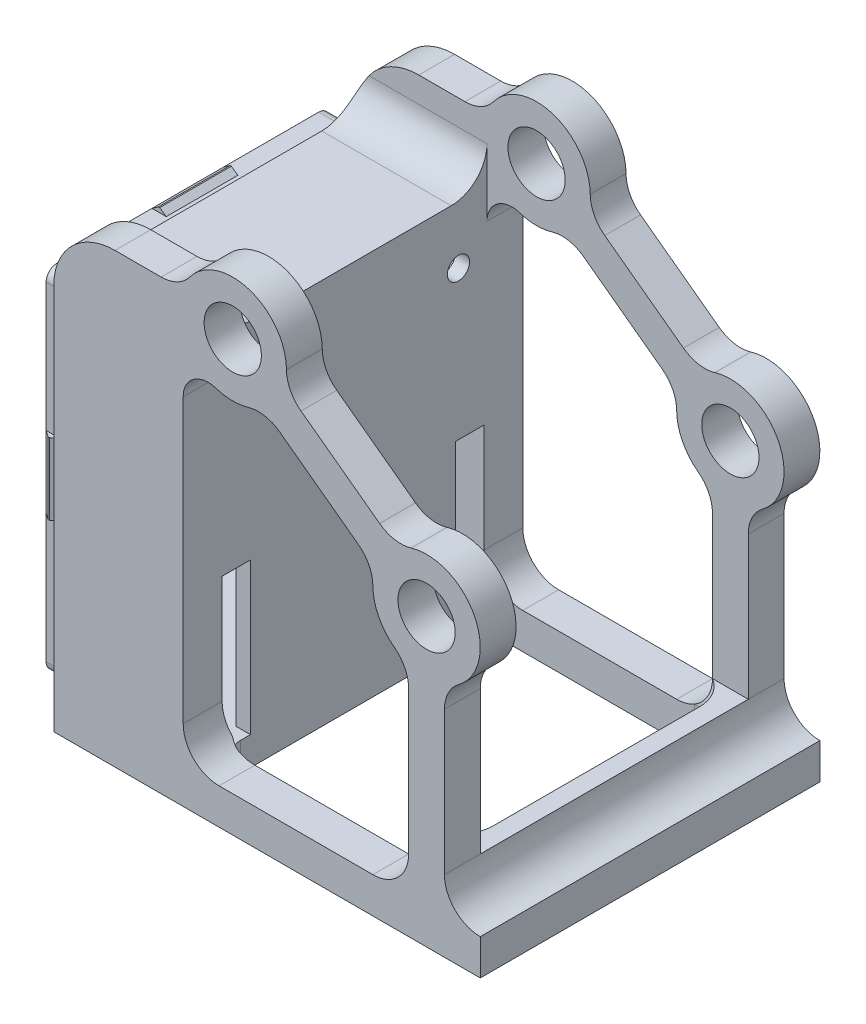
SolidWorks part; units mm, degrees
ref_plane "Alzado" through (0, 0, 0) normal (0, 0, 1) x (1, 0, 0)
ref_plane "Planta" through (0, 0, 0) normal (0, 1, 0) x (1, 0, 0)
ref_plane "Vista lateral" through (0, 0, 0) normal (1, 0, 0) x (0, 0, -1)
sketch "Croquis1" plane through (0, 0, 0) normal (0, 0, 1) x (1, 0, 0)
  line L0 (-92.1577, 342.1001) -> (-65.0867, 322.1001) construction
  line L1 (-82.6291, 338.1686) -> (-71.6442, 330.053)
  line L2 (-85.6002, 334.1471) -> (-74.6153, 326.0315)
  line L3 (-65.0867, 322.1001) -> (-65.0867, 282.1001) construction
  line L4 (-62.5867, 312.1001) -> (-62.5867, 292.1001)
  line L5 (-57.5867, 287.1001) -> (-57.5867, 282.1001)
  line L6 (-57.5867, 282.1001) -> (-117.1577, 282.1001)
  line L7 (-117.1577, 282.1001) -> (-117.1577, 349.6001)
  line L8 (-117.1577, 349.6001) -> (-112.1577, 349.6001)
  line L9 (-92.1577, 342.1001) -> (-117.1577, 342.1001) construction
  line L10 (-102.1577, 344.6001) -> (-107.1577, 344.6001)
  line L11 (-102.1577, 339.6001) -> (-107.1577, 339.6001)
  line L12 (-112.1577, 334.6001) -> (-112.1577, 292.1001)
  line L13 (-67.5867, 312.1001) -> (-67.5867, 292.1001)
  line L14 (-107.1577, 287.1001) -> (-72.5867, 287.1001)
  arc A0 (-72.5865, 322.046) -> (-74.6153, 326.0315) centre (-77.5863, 322.0099) ccw
  arc A1 (-90.0059, 334.9154) -> (-85.6002, 334.1471) centre (-88.5713, 330.1256) cw
  circle A2 centre (-65.0867, 322.1001) radius 4
  circle A3 centre (-92.1577, 342.1001) radius 4
  arc A4 (-84.6579, 342.1541) -> (-98.1577, 346.6001) centre (-92.1577, 342.1001) ccw
  arc A5 (-72.5865, 322.046) -> (-69.5867, 316.1001) centre (-65.0867, 322.1001) ccw
  arc A6 (-84.6579, 342.1541) -> (-82.6291, 338.1686) centre (-79.6581, 342.1902) ccw
  arc A7 (-67.2385, 329.2847) -> (-71.6442, 330.053) centre (-68.6731, 334.0745) cw
  arc A8 (-60.5867, 316.1001) -> (-62.5867, 312.1001) centre (-57.5867, 312.1001) ccw
  arc A9 (-62.5867, 292.1001) -> (-57.5867, 287.1001) centre (-57.5867, 292.1001) ccw
  arc A10 (-98.1577, 346.6001) -> (-102.1577, 344.6001) centre (-102.1577, 349.6001) cw
  arc A11 (-112.1577, 349.6001) -> (-107.1577, 344.6001) centre (-107.1577, 349.6001) ccw
  arc A12 (-112.1577, 334.6001) -> (-107.1577, 339.6001) centre (-107.1577, 334.6001) cw
  arc A13 (-98.1577, 337.6001) -> (-102.1577, 339.6001) centre (-102.1577, 334.6001) ccw
  arc A14 (-112.1577, 292.1001) -> (-107.1577, 287.1001) centre (-107.1577, 292.1001) ccw
  arc A15 (-67.5867, 292.1001) -> (-72.5867, 287.1001) centre (-72.5867, 292.1001) cw
  arc A16 (-69.5867, 316.1001) -> (-67.5867, 312.1001) centre (-72.5867, 312.1001) cw
  arc A17 (-99.6577, 342.1001) -> (-98.1577, 337.6001) centre (-92.1577, 342.1001) ccw construction
  arc A18 (-98.1577, 337.6001) -> (-90.0059, 334.9154) centre (-92.1577, 342.1001) ccw
  arc A19 (-98.1577, 346.6001) -> (-99.6577, 342.1001) centre (-92.1577, 342.1001) ccw construction
  arc A20 (-69.5867, 316.1001) -> (-65.0867, 314.6001) centre (-65.0867, 322.1001) ccw construction
  arc A21 (-60.5867, 316.1001) -> (-67.2385, 329.2847) centre (-65.0867, 322.1001) ccw
  arc A22 (-65.0867, 314.6001) -> (-60.5867, 316.1001) centre (-65.0867, 322.1001) ccw construction
  dimension "D5" = 8
  dimension "D6" = 8
  dimension "D7" = 15
  dimension "D8" = 5
  dimension "D10" = 2.5
  dimension "D11" = 5
  dimension "D13" = 5
  dimension "D15" = 25
  dimension "D16" = 40
  dimension "D1" = 27.0711
  dimension "D2" = 20
  dimension "D3" = 322.1001
  dimension "D4" = 65.0867
  dimension "D9" = 5
  dimension "D12" = 5
  dimension "D14" = 2.5
extrude "Saliente-Extruir1" add sketch "Croquis1" along normal blind 5 contours A11 L10 A10 A4 A6 L1 A7 A21 A8 L4 A9 L5 L6 L7 L8
ref_plane "Plano1" through (0, 0, -18.7157) normal (0, 0, -1) x (-1, 0, 0)
ref_plane "Plano3" through (-122.1577, 0, 0) normal (-1, 0, 0) x (0, 0, 1)
mirror "Simetría2" about plane through (0, 0, -18.7157) normal (0, 0, -1)
sketch "Croquis2" plane through (-122.1577, 0, 0) normal (-1, 0, 0) x (0, 0, 1)
  line L59 (-13.9386, 286.1001) -> (-5.7128, 286.1001)
  line L66 (-36.9957, 286.1001) -> (-13.9386, 286.1001)
  line L67 (-36.9957, 332.05) -> (-36.9957, 286.1001)
  line L68 (-0.4357, 332.05) -> (-36.9957, 332.05)
  line L69 (-0.4357, 286.1001) -> (-0.4357, 332.05)
  line L70 (-5.7128, 286.1001) -> (-0.4357, 286.1001)
  line L88 (-38.0052, 284.983) -> (-37.6518, 284.7466)
  line L89 (-37.6518, 284.7466) -> (-37.3436, 284.6392)
  line L90 (-37.3436, 284.6392) -> (-37.0896, 284.6013)
  line L91 (-37.0896, 284.6013) -> (-23.7157, 284.6001)
  line L92 (-23.7157, 284.6001) -> (-13.7157, 284.6001)
  line L93 (-13.7157, 284.6001) -> (-0.298, 284.6033)
  line L94 (-0.298, 284.6033) -> (0.089, 284.6888)
  line L95 (0.089, 284.6888) -> (0.4344, 284.8747)
  line L96 (0.4344, 284.8747) -> (0.6556, 285.0683)
  line L97 (0.6556, 285.0683) -> (0.8735, 285.3562)
  line L98 (0.8735, 285.3562) -> (1.0185, 285.7206)
  line L99 (1.0185, 285.7206) -> (1.0628, 286.0032)
  line L100 (1.0628, 286.0032) -> (1.0643, 297.895)
  line L101 (1.0643, 297.895) -> (1.0643, 304.0751)
  line L102 (1.0643, 304.0751) -> (1.0643, 314.0751)
  line L103 (1.0643, 314.0751) -> (1.0612, 332.2296)
  line L104 (1.0612, 332.2296) -> (0.949, 332.6342)
  line L105 (0.949, 332.6342) -> (0.8078, 332.892)
  line L106 (0.8078, 332.892) -> (0.62, 333.1196)
  line L107 (0.62, 333.1196) -> (0.3082, 333.3591)
  line L108 (0.3082, 333.3591) -> (-0.0562, 333.5042)
  line L109 (-0.0562, 333.5042) -> (-0.3417, 333.5488)
  line L110 (-0.3417, 333.5488) -> (-13.7157, 333.5501)
  line L111 (-13.7157, 333.5501) -> (-23.7157, 333.5501)
  line L112 (-23.7157, 333.5501) -> (-37.1122, 333.5471)
  line L113 (-37.1122, 333.5471) -> (-37.3617, 333.5065)
  line L114 (-37.3617, 333.5065) -> (-37.6397, 333.4079)
  line L115 (-37.6397, 333.4079) -> (-37.945, 333.2167)
  line L116 (-37.945, 333.2167) -> (-38.1939, 332.9571)
  line L117 (-38.1939, 332.9571) -> (-38.3466, 332.7059)
  line L118 (-38.3466, 332.7059) -> (-38.4498, 332.4295)
  line L119 (-38.4498, 332.4295) -> (-38.4955, 332.1318)
  line L120 (-38.4955, 332.1318) -> (-38.4957, 314.0751)
  line L121 (-38.4957, 314.0751) -> (-38.4957, 304.0751)
  line L122 (-38.4957, 304.0751) -> (-38.4902, 285.9087)
  line L123 (-38.4902, 285.9087) -> (-38.3803, 285.5159)
  line L124 (-38.3803, 285.5159) -> (-38.2392, 285.2581)
  line L125 (-38.2392, 285.2581) -> (-38.0052, 284.983)
extrude "Saliente-Extruir2" add sketch "Croquis2" against normal blind 21.08
sketch "Croquis3" plane through (-117.1577, 0, 0) normal (-1, 0, 0) x (0, 0, 1)
  line L0 (-42.4313, 349.6001) -> (-42.4313, 282.1001) construction
  line L2 (-42.4313, 336.05) -> (-42.4313, 282.1001)
  line L3 (-42.4313, 282.1001) -> (5, 282.1001)
  line L4 (5, 336.05) -> (5, 282.1001)
  line L5 (-0.4357, 332.05) -> (-36.9957, 332.05) construction
  line L6 (-36.9957, 332.05) -> (-0.4357, 332.05)
  line L7 (-36.9957, 332.05) -> (-36.9957, 286.1001)
  line L8 (-36.9957, 286.1001) -> (-0.4357, 286.1001)
  line L9 (-0.4357, 332.05) -> (-0.4357, 286.1001)
  line L10 (-36.9957, 332.05) -> (-36.9957, 286.1001) construction
  line L11 (-36.9957, 286.1001) -> (-0.4357, 286.1001) construction
  line L12 (-0.4357, 286.1001) -> (-0.4357, 332.05) construction
  line L14 (5, 349.6001) -> (5, 282.1001) construction
  line L15 (-42.4313, 282.1001) -> (-37.4313, 282.1001) construction
  line L16 (-42.4313, 336.05) -> (5, 336.05)
  line L17 (-36.9957, 286.1001) -> (-36.9957, 282.1001) construction
  line L18 (-36.9957, 332.05) -> (-36.9957, 336.05) construction
extrude "Saliente-Extruir3" add sketch "Croquis3" against normal up to surface (16.08 mm away)
ref_plane "Plano2" through (-106.0777, 0, 0) normal (1, 0, 0) x (0, 0, -1)
sketch "Croquis4" plane through (-106.0777, 0, 0) normal (1, 0, 0) x (0, 0, -1)
  line L9 (33.0497, 307.2351) -> (36.9957, 307.2351)
  line L10 (36.9957, 307.2351) -> (36.9957, 286.1001)
  line L11 (36.9957, 286.1001) -> (33.0497, 286.1001)
  line L12 (33.0497, 286.1001) -> (33.0497, 307.2351)
  line L13 (4.3816, 299.6151) -> (4.3816, 286.1001)
  line L14 (4.3816, 286.1001) -> (0.4357, 286.1001)
  line L15 (0.4357, 286.1001) -> (0.4357, 307.2351)
  line L16 (0.4357, 307.2351) -> (4.3816, 307.2351)
  line L17 (4.3816, 307.2351) -> (4.3816, 299.6151)
  line L82 (35.5897, 306.5591) -> (35.5897, 305.371)
  line L83 (34.4016, 306.5591) -> (35.5897, 306.5591)
  line L84 (34.4016, 305.371) -> (34.4016, 306.5591)
  line L85 (35.5897, 305.371) -> (34.4016, 305.371)
  line L86 (35.5897, 304.0191) -> (35.5897, 302.831)
  line L87 (34.4016, 304.0191) -> (35.5897, 304.0191)
  line L88 (34.4016, 302.831) -> (34.4016, 304.0191)
  line L89 (35.5897, 302.831) -> (34.4016, 302.831)
  line L90 (35.5897, 301.4791) -> (35.5897, 300.291)
  line L91 (35.5897, 300.291) -> (34.4016, 300.291)
  line L92 (34.4016, 300.291) -> (34.4016, 301.4791)
  line L93 (34.4016, 301.4791) -> (35.5897, 301.4791)
  line L94 (35.5897, 298.9391) -> (35.5897, 297.751)
  line L95 (34.4016, 298.9391) -> (35.5897, 298.9391)
  line L96 (34.4016, 297.751) -> (34.4016, 298.9391)
  line L97 (35.5897, 297.751) -> (34.4016, 297.751)
  line L98 (35.5897, 296.3991) -> (35.5897, 295.211)
  line L99 (35.5897, 295.211) -> (34.4016, 295.211)
  line L100 (34.4016, 295.211) -> (34.4016, 296.3991)
  line L101 (34.4016, 296.3991) -> (35.5897, 296.3991)
  line L102 (35.5897, 292.671) -> (34.4016, 292.671)
  line L103 (35.5897, 293.8591) -> (35.5897, 292.671)
  line L104 (34.4016, 293.8591) -> (35.5897, 293.8591)
  line L105 (34.4016, 292.671) -> (34.4016, 293.8591)
  line L106 (35.5897, 290.131) -> (34.4016, 290.131)
  line L107 (35.5897, 291.3191) -> (35.5897, 290.131)
  line L108 (34.4016, 291.3191) -> (35.5897, 291.3191)
  line L109 (34.4016, 290.131) -> (34.4016, 291.3191)
  line L110 (35.5897, 287.591) -> (34.4016, 287.591)
  line L111 (35.5897, 288.7791) -> (35.5897, 287.591)
  line L112 (34.4016, 287.591) -> (34.4016, 288.7791)
  line L113 (34.4016, 288.7791) -> (35.5897, 288.7791)
  line L114 (1.8416, 287.591) -> (3.0297, 287.591)
  line L115 (1.8416, 288.7791) -> (1.8416, 287.591)
  line L116 (3.0297, 288.7791) -> (1.8416, 288.7791)
  line L117 (3.0297, 287.591) -> (3.0297, 288.7791)
  line L118 (3.0297, 291.3191) -> (3.0297, 290.131)
  line L119 (3.0297, 290.131) -> (1.8416, 290.131)
  line L120 (1.8416, 290.131) -> (1.8416, 291.3191)
  line L121 (1.8416, 291.3191) -> (3.0297, 291.3191)
  line L122 (3.0297, 292.671) -> (3.0297, 293.8591)
  line L123 (1.8416, 292.671) -> (3.0297, 292.671)
  line L124 (1.8416, 293.8591) -> (1.8416, 292.671)
  line L125 (3.0297, 293.8591) -> (1.8416, 293.8591)
  line L126 (3.0297, 295.211) -> (1.8416, 295.211)
  line L127 (1.8416, 295.211) -> (1.8416, 296.3991)
  line L128 (1.8416, 296.3991) -> (3.0297, 296.3991)
  line L129 (3.0297, 296.3991) -> (3.0297, 295.211)
  line L130 (1.8416, 297.751) -> (3.0297, 297.751)
  line L131 (1.8416, 298.9391) -> (1.8416, 297.751)
  line L132 (3.0297, 297.751) -> (3.0297, 298.9391)
  line L133 (3.0297, 298.9391) -> (1.8416, 298.9391)
  line L134 (1.8416, 300.291) -> (3.0297, 300.291)
  line L135 (1.8416, 300.291) -> (1.8416, 301.4791)
  line L136 (1.8416, 301.4791) -> (3.0297, 301.4791)
  line L137 (3.0297, 301.4791) -> (3.0297, 300.291)
  line L138 (1.8416, 302.831) -> (3.0297, 302.831)
  line L139 (1.8416, 304.0191) -> (1.8416, 302.831)
  line L140 (3.0297, 302.831) -> (3.0297, 304.0191)
  line L141 (3.0297, 304.0191) -> (1.8416, 304.0191)
  line L142 (3.0297, 305.371) -> (1.8416, 305.371)
  line L143 (1.8416, 305.371) -> (1.8416, 306.5591)
  line L144 (1.8416, 306.5591) -> (3.0297, 306.5591)
  line L145 (3.0297, 306.5591) -> (3.0297, 305.371)
extrude "Saliente-Extruir4" add sketch "Croquis4" against normal blind 5
sketch "Croquis7" plane through (0, 0, -37.4313) normal (0, 0, 1) x (1, 0, 0)
  line L0 (-112.1577, 349.6001) -> (-117.1577, 349.6001) construction
  line L1 (-57.5867, 282.1001) -> (-57.5867, 287.1001) construction
  line L2 (-112.1577, 349.6001) -> (-117.1577, 349.6001)
  line L3 (-57.5867, 282.1001) -> (-57.5867, 287.1001)
  line L4 (-107.1577, 344.6001) -> (-107.1577, 342.1001)
  line L5 (-107.1577, 342.1001) -> (-117.1577, 342.1001)
  line L6 (-117.1577, 349.6001) -> (-117.1577, 282.1001) construction
  line L7 (-117.1577, 342.1001) -> (-117.1577, 349.6001)
  line L8 (-62.5867, 292.1001) -> (-65.0867, 292.1001)
  line L9 (-65.0867, 292.1001) -> (-65.0867, 282.1001)
  line L10 (-117.1577, 282.1001) -> (-57.5867, 282.1001) construction
  line L11 (-65.0867, 282.1001) -> (-57.5867, 282.1001)
  line L12 (-62.5867, 292.1001) -> (-62.5867, 312.1001) construction
  line L13 (-102.1577, 344.6001) -> (-107.1577, 344.6001) construction
  arc A0 (-112.1577, 349.6001) -> (-107.1577, 344.6001) centre (-107.1577, 349.6001) ccw construction
  arc A1 (-62.5867, 292.1001) -> (-57.5867, 287.1001) centre (-57.5867, 292.1001) ccw construction
  arc A2 (-112.1577, 349.6001) -> (-107.1577, 344.6001) centre (-107.1577, 349.6001) ccw
  arc A3 (-62.5867, 292.1001) -> (-57.5867, 287.1001) centre (-57.5867, 292.1001) ccw
  dimension "D1" = 2.5
  dimension "D2" = 2.5
extrude "Saliente-Extruir7" add sketch "Croquis7" along normal up to surface (37.4313 mm away)
fillet "Redondeo3" radius 5 4 edges at (-107.1577, 343.3501, -37.4313) (-107.1577, 343.3501, 0) (-65.0867, 287.1001, 0) (-65.0867, 287.1001, -37.4313)
sketch "Croquis8" plane through (-122.1577, 0, 0) normal (-1, 0, 0) x (0, 0, 1)
  line L0 (-36.9957, 286.1001) -> (-0.4357, 286.1001) construction
  line L1 (-0.4357, 286.1001) -> (-0.4357, 332.05) construction
  line L2 (-36.9957, 332.05) -> (-36.9957, 286.1001) construction
  line L3 (-0.4357, 332.05) -> (-36.9957, 332.05) construction
  line L4 (-36.9957, 286.1001) -> (-0.4357, 286.1001)
  line L5 (-0.4357, 286.1001) -> (-0.4357, 332.05)
  line L6 (-36.9957, 332.05) -> (-36.9957, 286.1001)
  line L7 (-0.4357, 332.05) -> (-36.9957, 332.05)
  line L10 (2.5643, 335.05) -> (-39.9957, 335.05)
  line L11 (-39.9957, 335.05) -> (-39.9957, 283.1001)
  line L12 (-39.9957, 283.1001) -> (2.5643, 283.1001)
  line L13 (2.5643, 283.1001) -> (2.5643, 335.05)
  dimension "D1" = 3
extrude "Saliente-Extruir8" add sketch "Croquis8" against normal up to surface (5 mm away) contours L12 L13 L10 L11 M13 M49 M48 M47 M46 M45 M44 M43 M42 M41 M40 M39 M38 M37 M36 M35 M34 M33 M32 M31 M30 M29 M28 M27 M26 M25 M24 M23 M22 M21 M20 M19 M18 M17 M16 M15 M14 | M49 M13 M14 M15 M16 M17 M18 M19 M20 M21 M22 M23 M24 M25 M26 M27 M28 M29 M30 M31 M32 M33 M34 M35 M36 M37 M38 M39 M40 M41 M42 M43 M44 M45 M46 M47 M48 M12 M9 M10 M11
sketch "Croquis9" plane through (-122.1577, 0, 0) normal (-1, 0, 0) x (0, 0, 1)
  line L10 (-18.7157, 333.55) -> (-18.7157, -49666.45) construction
  line L11 (1.0643, 309.075) -> (-49998.9357, 309.075) construction
  line L12 (-36.9957, 333.55) -> (-0.4357, 333.55)
  line L13 (1.0643, 332.05) -> (1.0643, 286.1001)
  line L14 (-38.4957, 284.6001) -> (1.0643, 284.6001)
  line L15 (1.0643, 284.6001) -> (1.0643, 333.55)
  line L16 (-38.4957, 333.55) -> (-38.4957, 284.6001)
  line L17 (1.0643, 333.55) -> (-38.4957, 333.55)
  line L18 (-38.4957, 284.6001) -> (1.0643, 284.6001) construction
  line L19 (1.0643, 284.6001) -> (1.0643, 333.55) construction
  line L20 (-38.4957, 333.55) -> (-38.4957, 284.6001) construction
  line L21 (1.0643, 333.55) -> (-38.4957, 333.55) construction
  line L22 (-0.4357, 284.6001) -> (-36.9957, 284.6001)
  line L23 (-38.4957, 286.1001) -> (-38.4957, 332.05)
  arc A0 (-36.9957, 333.55) -> (-38.4957, 332.05) centre (-36.9957, 332.05) ccw
  arc A1 (-0.4357, 333.55) -> (1.0643, 332.05) centre (-0.4357, 332.05) cw
  arc A2 (-0.4357, 284.6001) -> (1.0643, 286.1001) centre (-0.4357, 286.1001) ccw
  arc A3 (-36.9957, 284.6001) -> (-38.4957, 286.1001) centre (-36.9957, 286.1001) cw
  point P5 (-18.7157, 333.55)
  point P8 (1.0643, 309.075)
  dimension "D2" = 1.5
  dimension "D1" = 1.5
extrude "Cortar-Extruir1" cut sketch "Croquis9" against normal up to surface (5 mm away) flip side to cut
sketch "Croquis12" plane through (-101.0777, 0, 0) normal (1, 0, 0) x (0, 0, -1)
  line L0 (0.4357, 332.05) -> (36.9957, 332.05) construction
  line L1 (0.4357, 286.1001) -> (0.4357, 332.05) construction
  line L2 (8.2357, 328) -> (8.2357, 332.05)
  line L3 (8.2357, 332.05) -> (0.4357, 332.05)
  line L4 (0.4357, 332.05) -> (0.4357, 323.75)
  line L5 (0.4357, 323.75) -> (3.9857, 323.75)
  line L6 (18.7157, 333.55) -> (18.7157, 50333.55) construction
  line L7 (0.4357, 333.55) -> (36.9957, 333.55) construction
  line L8 (36.9957, 323.75) -> (33.4457, 323.75)
  line L9 (36.9957, 332.05) -> (36.9957, 323.75)
  line L10 (29.1957, 332.05) -> (36.9957, 332.05)
  line L11 (29.1957, 328) -> (29.1957, 332.05)
  circle A0 centre (3.9857, 328) radius 1.55
  circle A1 centre (3.9857, 328) radius 2.875 construction
  arc A2 (3.9857, 323.75) -> (8.2357, 328) centre (3.9857, 328) ccw
  arc A3 (33.4457, 323.75) -> (29.1957, 328) centre (33.4457, 328) cw
  circle A4 centre (33.4457, 328) radius 1.55
  circle A5 centre (33.4457, 328) radius 2.875 construction
  point P16 (18.7157, 333.55)
  dimension "D1" = 3.1
  dimension "D2" = 5.75
  dimension "D5" = 4.25
  dimension "D3" = 4.05
  dimension "D4" = 3.55
extrude "Saliente-Extruir11" add sketch "Croquis12" against normal blind 11.6145 contours A3 L8 L11 A4 M14 M13 | L5 A2 L2 A0 M13 M16
sketch "Croquis14" plane through (-112.6923, 0, 0) normal (-1, 0, 0) x (0, 0, 1)
  line L0 (-3.9857, 329.55) -> (-3.9857, 332.05)
  line L1 (-0.4357, 332.05) -> (-36.9957, 332.05) construction
  line L2 (-3.9857, 332.05) -> (-8.2357, 332.05)
  line L3 (-8.2357, 328) -> (-8.2357, 332.05) construction
  line L4 (-8.2357, 332.05) -> (-8.2357, 328)
  line L5 (-3.9857, 323.75) -> (-3.9857, 326.45)
  line L6 (-18.7157, 336.05) -> (-18.7157, 50336.05) construction
  line L7 (0, 336.05) -> (-37.4313, 336.05) construction
  line L8 (-29.1957, 332.05) -> (-29.1957, 328)
  line L9 (-33.4457, 332.05) -> (-29.1957, 332.05)
  line L10 (-33.4457, 329.55) -> (-33.4457, 332.05)
  line L11 (-33.4457, 323.75) -> (-33.4457, 326.45)
  circle A0 centre (-3.9857, 328) radius 1.55 construction
  arc A1 (-8.2357, 328) -> (-3.9857, 323.75) centre (-3.9857, 328) ccw construction
  arc A2 (-8.2357, 328) -> (-3.9857, 323.75) centre (-3.9857, 328) ccw
  arc A3 (-3.9857, 329.55) -> (-3.9857, 326.45) centre (-3.9857, 328) cw
  arc A4 (-29.1957, 328) -> (-33.4457, 323.75) centre (-33.4457, 328) cw
  arc A5 (-33.4457, 329.55) -> (-33.4457, 326.45) centre (-33.4457, 328) ccw
  point P20 (-18.7157, 336.05)
extrude "Cortar-Extruir2" cut sketch "Croquis14" against normal offset from surface (9.6145 mm away) 2
sketch "Croquis15" plane through (-101.0777, 0, 0) normal (1, 0, 0) x (0, 0, -1)
  line L8 (8.2357, 332.05) -> (8.2357, 328)
  line L9 (29.1957, 332.05) -> (8.2357, 332.05)
  line L10 (29.1957, 328) -> (29.1957, 332.05)
  line L11 (36.9957, 323.75) -> (33.4457, 323.75)
  line L12 (36.9957, 286.1001) -> (36.9957, 323.75)
  line L13 (0.4357, 286.1001) -> (36.9957, 286.1001)
  line L14 (0.4357, 323.75) -> (0.4357, 286.1001)
  line L15 (3.9857, 323.75) -> (0.4357, 323.75)
  line L16 (8.2357, 332.05) -> (8.2357, 328)
  line L17 (29.1957, 332.05) -> (8.2357, 332.05)
  line L18 (29.1957, 328) -> (29.1957, 332.05)
  line L19 (36.9957, 323.75) -> (33.4457, 323.75)
  line L20 (36.9957, 286.1001) -> (36.9957, 323.75)
  line L21 (0.4357, 286.1001) -> (36.9957, 286.1001)
  line L22 (0.4357, 323.75) -> (0.4357, 286.1001)
  line L23 (3.9857, 323.75) -> (0.4357, 323.75)
  line L24 (42.4313, 336.05) -> (-5, 336.05)
  line L25 (-5, 336.05) -> (-5, 287.1001)
  line L26 (-5, 287.1001) -> (0, 287.1001)
  line L27 (0, 287.1001) -> (0, 282.1001)
  line L28 (0, 282.1001) -> (37.4313, 282.1001)
  line L29 (37.4313, 282.1001) -> (37.4313, 287.1001)
  line L30 (37.4313, 287.1001) -> (42.4313, 287.1001)
  line L31 (42.4313, 287.1001) -> (42.4313, 336.05)
  line L32 (42.4313, 336.05) -> (-5, 336.05)
  line L33 (-5, 336.05) -> (-5, 287.1001)
  line L34 (-5, 287.1001) -> (0, 287.1001)
  line L35 (0, 287.1001) -> (0, 282.1001)
  line L36 (0, 282.1001) -> (37.4313, 282.1001)
  line L37 (37.4313, 282.1001) -> (37.4313, 287.1001)
  line L38 (37.4313, 287.1001) -> (42.4313, 287.1001)
  line L39 (42.4313, 287.1001) -> (42.4313, 336.05)
  circle A1 centre (33.4457, 328) radius 1.55
  circle A2 centre (33.4457, 328) radius 1.55
  circle A3 centre (3.9857, 328) radius 1.55
  circle A4 centre (3.9857, 328) radius 1.55
  arc A6 (29.1957, 328) -> (33.4457, 323.75) centre (33.4457, 328) ccw
  arc A7 (3.9857, 323.75) -> (8.2357, 328) centre (3.9857, 328) ccw
  arc A8 (29.1957, 328) -> (33.4457, 323.75) centre (33.4457, 328) ccw
  arc A9 (3.9857, 323.75) -> (8.2357, 328) centre (3.9857, 328) ccw
  dimension "D1" = 0
  dimension "D2" = 0
  dimension "D3" = 0
  dimension "D4" = 0
extrude "Saliente-Extruir12" add sketch "Croquis15" along normal blind 2
sketch "Croquis16" plane through (0, 286.1001, 0) normal (0, 1, 0) x (1, 0, 0)
  line L0 (-111.0777, 4.3816) -> (-106.0777, 4.3816) construction
  line L1 (-111.0777, 33.0497) -> (-106.0777, 33.0497) construction
  line L2 (-111.0777, 4.3816) -> (-106.0777, 4.3816) construction
  line L3 (-111.0777, 33.0497) -> (-106.0777, 33.0497) construction
  line L4 (-99.0777, 0.4357) -> (-99.0777, 36.9957) construction
  line L5 (-99.0777, 33.0497) -> (-101.0777, 33.0497)
  line L6 (-99.0777, 33.0497) -> (-99.0777, 4.3816)
  line L7 (-99.0777, 4.3816) -> (-101.0777, 4.3816)
  line L8 (-101.0777, 33.0497) -> (-101.0777, 4.3816)
  dimension "D1" = 2
extrude "Saliente-Extruir13" add sketch "Croquis16" along normal up to next
sketch "Croquis17" plane through (-112.6923, 0, 0) normal (-1, 0, 0) x (0, 0, 1)
  circle A0 centre (-3.9857, 328) radius 2.875
  circle A1 centre (-33.4457, 328) radius 2.875
  dimension "D1" = 5.75
extrude "Cortar-Extruir3" cut sketch "Croquis17" against normal up to surface (11.6145 mm away)
sketch "Croquis18" plane through (0, 0, -0.4357) normal (0, 0, -1) x (-1, 0, 0)
  line L0 (111.0777, 307.2351) -> (106.0777, 307.2351) construction
  line L1 (111.0777, 307.2351) -> (106.0777, 307.2351) construction
  line L2 (101.0777, 286.1001) -> (99.0777, 286.1001) construction
  line L3 (101.0777, 286.1001) -> (99.0777, 286.1001) construction
  line L4 (112.6923, 323.75) -> (99.0777, 323.75) construction
  line L5 (112.6923, 323.75) -> (99.0777, 323.75) construction
  line L6 (101.0777, 323.75) -> (101.0777, 324.4573)
  line L8 (99.0777, 323.75) -> (99.0777, 307.2351)
  line L9 (99.0777, 307.2351) -> (101.0777, 307.2351)
  line L10 (101.0777, 323.75) -> (101.0777, 307.2351)
  line L11 (101.0777, 324.4573) -> (99.0777, 324.4573)
  line L12 (99.0777, 287.1001) -> (99.0777, 336.05) construction
  line L13 (99.0777, 324.4573) -> (99.0777, 323.75)
extrude "Saliente-Extruir14" add sketch "Croquis18" along normal up to surface (36.56 mm away)
sketch "Croquis19" plane through (0, 0, -18.7157) normal (0, 0, -1) x (-1, 0, 0)
  line L0 (122.1577, 333.55) -> (121.2437, 334.19)
  line L1 (117.1577, 333.55) -> (122.1577, 333.55) construction
  line L2 (122.1577, 332.05) -> (122.1577, 333.55) construction
  line L3 (121.2437, 334.19) -> (121.0717, 334.19)
  line L4 (121.0717, 334.19) -> (120.1577, 333.55)
  line L5 (120.1577, 333.55) -> (122.1577, 333.55)
  line L6 (122.1577, 332.05) -> (122.1577, 286.1001) construction
  line L7 (122.1577, 332.05) -> (122.1577, 286.1001) construction
  line L8 (122.1577, 309.075) -> (50122.1577, 309.075) construction
  line L9 (120.1577, 284.6001) -> (122.1577, 284.6001)
  line L10 (121.0717, 283.9601) -> (120.1577, 284.6001)
  line L11 (121.2437, 283.9601) -> (121.0717, 283.9601)
  line L12 (122.1577, 284.6001) -> (121.2437, 283.9601)
  point P14 (122.1577, 309.075)
  dimension "D1" = 0.64
  dimension "D2" = 2
  dimension "D3" = 145
  dimension "D4" = 145
extrude "Saliente-Extruir15" add sketch "Croquis19" along normal mid plane 10 contours L4 L5 L0 L3
ref_plane "Plano4" through (0, 309.075, 0) normal (0, -1, 0) x (-1, 0, 0)
sketch "Croquis20" plane through (0, 309.075, 0) normal (0, -1, 0) x (-1, 0, 0)
  line L0 (122.1577, 38.4957) -> (121.2437, 39.1357)
  line L1 (121.2437, 39.1357) -> (121.0717, 39.1357)
  line L2 (121.0717, 39.1357) -> (120.1577, 38.4957)
  line L3 (117.1577, 38.4957) -> (122.1577, 38.4957) construction
  line L4 (120.1577, 38.4957) -> (122.1577, 38.4957)
  line L5 (122.1577, 36.9957) -> (122.1577, 38.4957) construction
  line L6 (120.1577, 18.7157) -> (50120.1577, 18.7157) construction
  line L7 (120.1577, 23.7157) -> (120.1577, 13.7157) construction
  line L8 (120.1577, -1.0643) -> (122.1577, -1.0643)
  line L9 (122.1577, -1.0643) -> (121.2437, -1.7043)
  line L10 (121.2437, -1.7043) -> (121.0717, -1.7043)
  line L11 (121.0717, -1.7043) -> (120.1577, -1.0643)
  point P14 (120.1577, 18.7157)
  dimension "D1" = 2
  dimension "D2" = 145
  dimension "D3" = 145
  dimension "D4" = 0.64
extrude "Saliente-Extruir16" add sketch "Croquis20" along normal mid plane 10
sketch "Croquis21" plane through (0, 286.1001, 0) normal (0, 1, 0) x (1, 0, 0)
  line L0 (-122.1577, 36.9957) -> (-122.1577, 23.7157) construction
  line L1 (-119.7377, 32.8913) -> (-113.7877, 32.8913)
  line L2 (-119.7377, 32.8913) -> (-119.7377, 25.8913)
  line L3 (-119.7377, 25.8913) -> (-113.7877, 25.8913)
  line L4 (-113.7877, 32.8913) -> (-113.7877, 25.8913)
  line L5 (-109.7877, 32.8913) -> (-103.8377, 32.8913)
  line L6 (-109.7877, 32.8913) -> (-109.7877, 25.8913)
  line L7 (-109.7877, 25.8913) -> (-103.8377, 25.8913)
  line L8 (-103.8377, 32.8913) -> (-103.8377, 25.8913)
  line L9 (-99.0777, 37.4313) -> (-70.0867, 37.4313) construction
  line L10 (-122.1577, 13.7157) -> (-122.1577, 0.4357) construction
  line L11 (-114.0577, 14.23) -> (-117.3577, 14.23)
  line L12 (-114.0577, 14.23) -> (-114.0577, 6)
  line L13 (-114.0577, 6) -> (-117.3577, 6)
  line L14 (-117.3577, 14.23) -> (-117.3577, 6)
  line L15 (-117.1577, -5) -> (-57.5867, -5) construction
  dimension "D1" = 2.42
  dimension "D2" = 5.95
  dimension "D3" = 7
  dimension "D4" = 4.54
  dimension "D5" = 4
  dimension "D6" = 4.8
  dimension "D7" = 3.3
  dimension "D8" = 11
  dimension "D9" = 8.23
extrude "Cortar-Extruir4" cut sketch "Croquis21" against normal through all
sketch "Croquis22" plane through (0, 282.1001, 0) normal (0, -1, 0) x (1, 0, 0)
  line L0 (-117.1577, -36.9957) -> (-122.1577, -36.9957) construction
  line L1 (-117.1577, -36.9957) -> (-103.8377, -36.9957)
  line L2 (-117.1577, -36.9957) -> (-117.1577, -0.4357)
  line L3 (-117.1577, -0.4357) -> (-103.8377, -0.4357)
  line L4 (-103.8377, -36.9957) -> (-103.8377, -0.4357)
  line L5 (-117.1577, -32.8913) -> (-117.1577, -42.4313) construction
  line L6 (-117.1577, -0.4357) -> (-122.1577, -0.4357) construction
  line L8 (-103.8377, -25.8913) -> (-103.8377, -32.8913) construction
extrude "Cortar-Extruir5" cut sketch "Croquis22" against normal up to surface (2.5 mm away)
fillet "Redondeo4" radius 2.5 4 edges at (-110.4977, 284.6001, -0.4357) (-103.8377, 284.6001, -13.1635) (-103.8377, 284.6001, -34.9435) (-110.4977, 284.6001, -36.9957)
fillet "Redondeo5" radius 3 2 edges at (-99.0777, 284.6001, -37.4313) (-99.0777, 284.6001, 0)
fillet "Redondeo6" radius 5 2 edges at (-99.0777, 287.1001, -39.7135) (-99.0777, 287.1001, 2.2822)
sketch "Croquis23" plane through (0, 0, 5) normal (0, 0, 1) x (1, 0, 0)
  line L0 (-117.1577, 349.6001) -> (-117.1577, 282.1001) construction
  line L1 (-102.1577, 344.6001) -> (-107.1577, 344.6001) construction
  line L3 (-108.6077, 344.6001) -> (-107.1577, 344.6001)
  line L4 (-107.1577, 344.6001) -> (-107.1577, 349.6001)
  line L5 (-107.1577, 349.6001) -> (-117.1577, 349.6001)
  line L6 (-112.1577, 349.6001) -> (-117.1577, 349.6001) construction
  line L7 (-117.1577, 349.6001) -> (-117.1577, 336.05)
  line L8 (-99.0777, 336.05) -> (-111.9429, 336.05) construction
  arc A0 (-108.6077, 344.6001) -> (-117.1577, 336.05) centre (-108.6077, 336.05) ccw
  arc A3 (-112.1577, 349.6001) -> (-107.1577, 344.6001) centre (-107.1577, 349.6001) ccw construction
extrude "Cortar-Extruir6" cut sketch "Croquis23" against normal through all
sketch "Croquis24" plane through (0, 0, -37.4313) normal (0, 0, 1) x (1, 0, 0)
  line L0 (-102.1577, 344.6001) -> (-108.6077, 344.6001) construction
  line L1 (-102.1577, 344.6001) -> (-102.1577, 342.1001) construction
  line L2 (-114.6493, 342.1001) -> (-102.1577, 342.1001) construction
  line L3 (-102.1577, 344.6001) -> (-108.6077, 344.6001)
  line L4 (-102.1577, 344.6001) -> (-102.1577, 342.1001)
  line L5 (-114.6493, 342.1001) -> (-102.1577, 342.1001)
  arc A0 (-108.6077, 344.6001) -> (-117.1577, 336.05) centre (-108.6077, 336.05) ccw construction
  arc A1 (-108.6077, 344.6001) -> (-114.6493, 342.1001) centre (-108.6077, 336.05) ccw
  arc A2 (-114.6493, 342.1001) -> (-117.1577, 336.05) centre (-108.6077, 336.05) ccw construction
extrude "Cortar-Extruir7" cut sketch "Croquis24" along normal up to surface (37.4313 mm away)
sketch "Croquis25" plane through (0, 0, 5) normal (0, 0, 1) x (1, 0, 0)
  line L0 (-99.0777, 336.05) -> (-99.0777, 292.1001) construction
  line L1 (-99.0777, 336.05) -> (-111.9429, 336.05) construction
  line L2 (-102.1577, 339.6001) -> (-107.1577, 339.6001) construction
  line L3 (-99.0777, 336.05) -> (-99.0777, 331.6672)
  line L4 (-99.0777, 336.05) -> (-111.9429, 336.05)
  line L5 (-102.1577, 339.6001) -> (-107.1577, 339.6001)
  line L6 (-99.0777, 331.6672) -> (-99.0777, 292.1001) construction
  arc A0 (-94.5038, 334.9764) -> (-99.0777, 331.6672) centre (-95.5936, 331.6672) ccw
  arc A1 (-98.1577, 337.6001) -> (-90.0059, 334.9154) centre (-92.1577, 342.1001) ccw construction
  arc A2 (-107.1577, 339.6001) -> (-111.9429, 336.05) centre (-107.1577, 334.6001) ccw construction
  arc A3 (-98.1577, 337.6001) -> (-102.1577, 339.6001) centre (-102.1577, 334.6001) ccw construction
  arc A4 (-98.1577, 337.6001) -> (-94.5038, 334.9764) centre (-92.1577, 342.1001) ccw
  arc A5 (-107.1577, 339.6001) -> (-111.9429, 336.05) centre (-107.1577, 334.6001) ccw
  arc A6 (-98.1577, 337.6001) -> (-102.1577, 339.6001) centre (-102.1577, 334.6001) ccw
  arc A7 (-94.5038, 334.9764) -> (-90.0059, 334.9154) centre (-92.1577, 342.1001) ccw construction
extrude "Saliente-Extruir17" add sketch "Croquis25" against normal up to surface (5 mm away)
sketch "Croquis26" plane through (0, 0, -42.4313) normal (0, 0, -1) x (-1, 0, 0)
  line L0 (99.0777, 292.1001) -> (99.0777, 336.05) construction
  line L1 (99.0777, 336.05) -> (111.9429, 336.05) construction
  line L2 (102.1577, 339.6001) -> (107.1577, 339.6001) construction
  line L3 (99.0777, 331.6672) -> (99.0777, 336.05)
  line L4 (99.0777, 336.05) -> (111.9429, 336.05)
  line L5 (102.1577, 339.6001) -> (107.1577, 339.6001)
  line L6 (99.0777, 292.1001) -> (99.0777, 331.6672) construction
  arc A0 (111.9429, 336.05) -> (107.1577, 339.6001) centre (107.1577, 334.6001) ccw construction
  arc A1 (102.1577, 339.6001) -> (98.1577, 337.6001) centre (102.1577, 334.6001) ccw construction
  arc A2 (90.0059, 334.9154) -> (98.1577, 337.6001) centre (92.1577, 342.1001) ccw construction
  arc A3 (99.0777, 331.6672) -> (94.5038, 334.9764) centre (95.5936, 331.6672) ccw construction
  arc A4 (111.9429, 336.05) -> (107.1577, 339.6001) centre (107.1577, 334.6001) ccw
  arc A5 (102.1577, 339.6001) -> (98.1577, 337.6001) centre (102.1577, 334.6001) ccw
  arc A6 (94.5038, 334.9764) -> (98.1577, 337.6001) centre (92.1577, 342.1001) ccw
  arc A7 (99.0777, 331.6672) -> (94.5038, 334.9764) centre (95.5936, 331.6672) ccw
  arc A8 (90.0059, 334.9154) -> (94.5038, 334.9764) centre (92.1577, 342.1001) ccw construction
extrude "Saliente-Extruir18" add sketch "Croquis26" against normal up to surface (5 mm away)
fillet "Redondeo7" radius 5 2 edges at (-108.1177, 336.05, 0) (-108.1177, 336.05, -37.4313)
